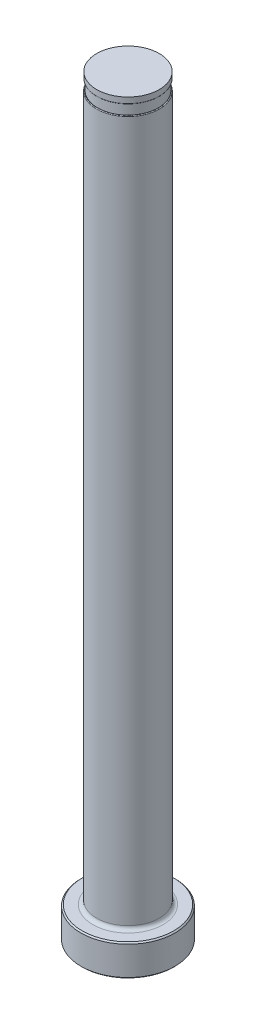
SolidWorks part; units mm, degrees
ref_plane "Front Plane" through (0, 0, 0) normal (0, 0, 1) x (1, 0, 0)
ref_plane "Top Plane" through (0, 0, 0) normal (0, 1, 0) x (1, 0, 0)
ref_plane "Right Plane" through (0, 0, 0) normal (1, 0, 0) x (0, 0, -1)
other "Configuration Table"
sketch "Sketch1" plane through (0, 0, 0) normal (0, 0, 1) x (1, 0, 0)
  line L0 (0, 259.9588) -> (0, -15.1925) construction
  line L1 (0, 0) -> (-9.525, 0)
  line L2 (-9.525, 0) -> (-9.525, 6.35)
  line L3 (-9.525, 6.35) -> (-6.35, 6.35)
  line L4 (-6.35, 6.35) -> (-6.35, 152.4)
  line L5 (-6.35, 152.4) -> (0, 152.4)
  line L6 (0, 152.4) -> (0, 0)
  dimension "L" = 152.4
  dimension "H" = 19.05
  dimension "T" = 6.35
  dimension "D" = 12.7
revolve "Revolve1" add sketch "Sketch1" angle 360 about L0
chamfer "Chamfer1" distance 0.254 angle 45 2 edges at (0, 6.35, 9.525) (0, 0, 9.525)
fillet "Fillet1" radius 0.762 1 edges at (0, 6.35, 6.35)
sketch "Sketch2" plane through (0, 0, 0) normal (0, 0, 1) x (1, 0, 0)
  line L0 (-6.35, 152.4) -> (-6.35, 7.112) construction
  line L1 (-6.35, 151.13) -> (-6.1468, 151.13)
  line L2 (-6.35, 151.13) -> (-6.35, 149.098)
  line L3 (-6.35, 149.098) -> (-6.1468, 149.098)
  line L4 (-6.1468, 151.13) -> (-6.1468, 149.098)
  line L5 (6.35, 152.4) -> (-6.35, 152.4) construction
  line L6 (0, 153.4483) -> (0, 147.3282) construction
  dimension "D1" = 2.032
  dimension "N" = 1.27
  dimension "FD" = 0.2032
  dimension "D3" = 12.2936
revolve "Vent Relief" cut sketch "Sketch2" angle 360 about L6
sketch "Sketch3" plane through (0, 0, 0) normal (0, 0, 1) x (1, 0, 0)
  line L0 (-6.1468, 150.114) -> (-6.1468, 86.614)
  line L1 (-6.1468, 151.13) -> (-6.1468, 149.098) construction
  line L2 (-6.35, 149.098) -> (-6.35, 7.112) construction
  line L3 (-6.35, 85.4964) -> (-6.35, 150.114)
  line L4 (-6.35, 150.114) -> (-6.1468, 150.114)
  arc A0 (-6.1468, 86.614) -> (-6.35, 85.4964) centre (-9.3218, 86.614) cw
  dimension "D1" = 3.175
  dimension "D2" = 63.5
extrude "D-Slot" cut sketch "Sketch3" against normal through all both and the other way through all
sketch "Sketch5" plane through (0, 0, 0) normal (0, 0, 1) x (1, 0, 0)
  line L0 (-6.35, 151.13) -> (6.35, 151.13) construction
  line L1 (-6.35, 152.4) -> (-6.3309, 152.4)
  line L2 (-6.35, 152.4) -> (-6.35, 151.13)
  line L3 (-6.35, 151.13) -> (-6.3309, 151.13)
  line L4 (-6.3309, 152.4) -> (-6.3309, 151.13)
  line L5 (0, 152.6877) -> (0, 150.5771) construction
  dimension "VP" = 0.019
revolve "Vent Diameter" cut sketch "Sketch5" angle 360 about L5
fillet "Fillet2" radius 0.127 2 edges at (6.35, 149.098, 0) (0, 151.13, 6.3309)
sketch "Pocket Sketch" plane through (0, 0, 0) normal (0, 0, 1) x (1, 0, 0)
  line L0 (-9.9219, 0) -> (-9.9219, 6.3754)
  line L1 (-9.9219, 6.3754) -> (-7.3104, 6.3754)
  line L2 (-6.5484, 7.1374) -> (-6.5484, 22.225)
  line L3 (-6.5484, 22.225) -> (0, 22.225)
  line L4 (0, 22.225) -> (0, 0)
  line L5 (0, 0) -> (-9.9219, 0)
  line L6 (0, 12.6104) -> (0, -2.4989) construction
  line L7 (-9.525, 6.096) -> (-9.525, 0.254) construction
  line L8 (9.271, 6.35) -> (-9.271, 6.35) construction
  line L9 (-6.35, 85.4964) -> (-6.35, 7.112) construction
  line L10 (-7.3104, 6.3754) -> (-6.5484, 7.1374)
  point P3 (-6.5484, 6.3754)
  dimension "D1" = 19.8437
  dimension "D2" = 0.3969
  dimension "D3" = 0.0254
  dimension "D4" = 0.1984
  dimension "D5" = 13.0969
  dimension "D6" = 22.225
